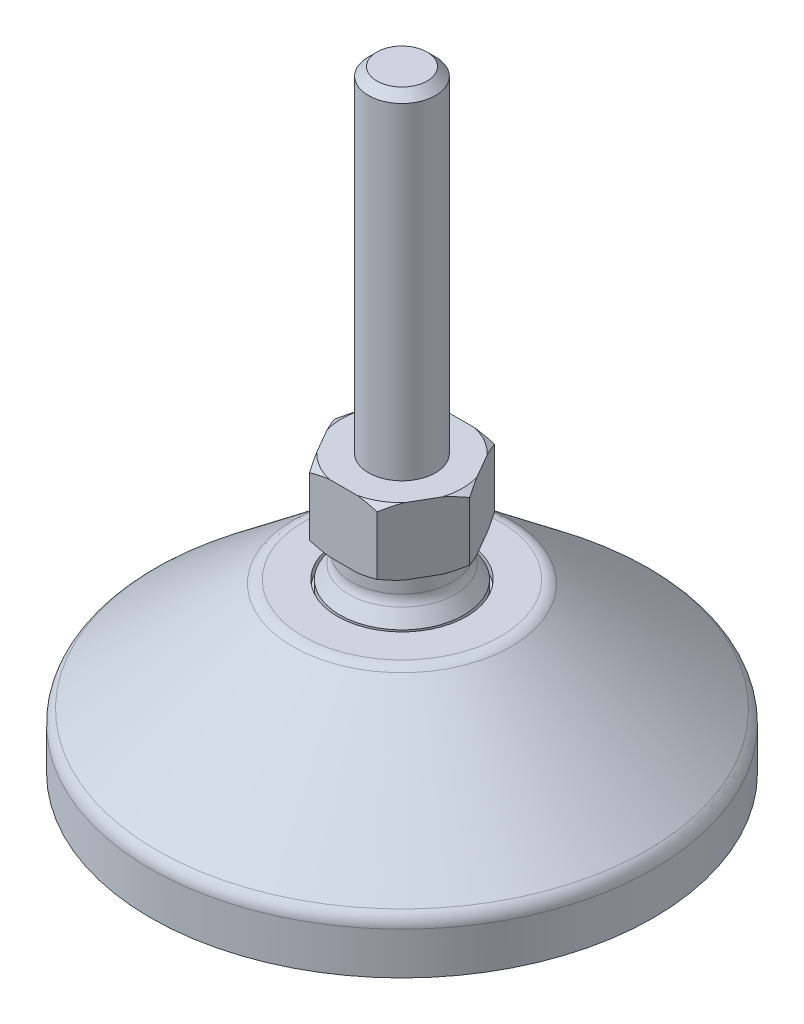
SolidWorks part; units mm, degrees
ref_plane "Front Plane" through (0, 0, 0) normal (0, 0, 1) x (1, 0, 0)
ref_plane "Top Plane" through (0, 0, 0) normal (0, 1, 0) x (1, 0, 0)
ref_plane "Right Plane" through (0, 0, 0) normal (1, 0, 0) x (0, 0, -1)
sketch "Sketch1" plane through (0, 0, 0) normal (0, 1, 0) x (1, 0, 0)
  circle A1 centre (0, 0) radius 25.75
  dimension "D1" = 51.5
extrude "Boss-Extrude1" add sketch "Sketch1" along normal blind 2
sketch "Sketch2" plane through (0, 2, 0) normal (0, 1, 0) x (1, 0, 0)
  circle A0 centre (0, 0) radius 30
  dimension "D1" = 60
extrude "Boss-Extrude2" add sketch "Sketch2" along normal blind 6
ref_plane "Plane1" through (0, 22, 0) normal (0, 1, 0) x (1, 0, 0)
sketch "Sketch3" plane through (0, 22, 0) normal (0, 1, 0) x (1, 0, 0)
  circle A0 centre (0, 0) radius 12.5
  dimension "D1" = 25
loft "Loft1" add profiles "Sketch3"
ref_plane "Plane2" through (0, 24.1, 0) normal (0, 1, 0) x (1, 0, 0)
sketch "Sketch4" plane through (0, 22, 0) normal (0, 1, 0) x (1, 0, 0)
  circle A0 centre (0, 0) radius 7.4
  dimension "D1" = 14.8
sketch "Sketch5" plane through (0, 24.1, 0) normal (0, 1, 0) x (1, 0, 0)
  circle A0 centre (0, 0) radius 6
  dimension "D1" = 12
loft "Loft2" add profiles "Sketch4", "Sketch5"
sketch "Sketch11" plane through (0, 22, 0) normal (0, 1, 0) x (1, 0, 0)
  circle A0 centre (0, 0) radius 7.4 construction
  circle A1 centre (0, 0) radius 7.4
  circle A2 centre (0, 0) radius 7.7
  dimension "D1" = 0.3
extrude "Cut-Extrude1" cut sketch "Sketch11" against normal blind 1
sketch "Sketch6" plane through (0, 24.1, 0) normal (0, 1, 0) x (1, 0, 0)
  circle A1 centre (0, 0) radius 6
  circle A2 centre (0, 0) radius 6
  dimension "D1" = 0
extrude "Boss-Extrude3" add sketch "Sketch6" along normal blind 2.9
sketch "Sketch7" plane through (0, 27, 0) normal (0, 1, 0) x (1, 0, 0)
  circle A0 centre (0, 0) radius 4
  dimension "D1" = 8
extrude "Boss-Extrude4" add sketch "Sketch7" along normal blind 48
sketch "Sketch8" plane through (0, 27, 0) normal (0, 1, 0) x (1, 0, 0)
  line L1 (8.0829, 0) -> (4.0415, 7)
  line L2 (4.0415, 7) -> (-4.0415, 7)
  line L3 (-4.0415, 7) -> (-8.0829, 0)
  line L4 (-8.0829, 0) -> (-4.0415, -7)
  line L5 (-4.0415, -7) -> (4.0415, -7)
  line L6 (4.0415, -7) -> (8.0829, 0)
  circle A0 centre (0, 0) radius 7 construction
  circle A1 centre (0, 0) radius 4 construction
  circle A2 centre (0, 0) radius 4
  dimension "D1" = 14
extrude "Boss-Extrude5" add sketch "Sketch8" along normal blind 8
sketch "Sketch9" plane through (0, 0, 0) normal (0, 0, 1) x (1, 0, 0)
  line L0 (-7.2, 35) -> (-8.0829, 34.5)
  line L1 (-8.0829, 35) -> (-4.0415, 35) construction
  line L2 (-8.0829, 35) -> (-8.0829, 27) construction
  line L3 (-8.0829, 27.5) -> (-7.2, 27)
  line L4 (-8.0829, 27) -> (-4.0415, 27) construction
  line L5 (-7.2, 35) -> (-7.2, 27) construction
  line L6 (0, -33) -> (0, 33) construction
  line L7 (-8.0829, 27.5) -> (-8.0829, 27)
  line L8 (-8.0829, 27) -> (-7.2, 27)
  line L9 (-7.2, 35) -> (-8.0829, 35)
  line L10 (-8.0829, 35) -> (-8.0829, 34.5)
  dimension "D1" = 7.2
  dimension "D2" = 0.5
  dimension "D3" = 0.5
revolve "Cut-Revolve1" cut sketch "Sketch9" angle 360 about axis through (0, 75, 0) along (0, -1, 0)
chamfer "Chamfer1" distance 1 angle 45 1 edges at (0, 75, 4)
sketch "Sketch10" plane through (0, 0, 0) normal (0, -1, 0) x (1, 0, 0)
  line L0 (3, 6) -> (20.6458, 6)
  line L2 (-3, -21.2897) -> (-3, -6)
  line L4 (3, -21.2897) -> (3, -6)
  line L5 (-3, -21.2897) -> (3, 21.2897) construction
  line L6 (-3, 21.2897) -> (3, -21.2897) construction
  line L7 (-20.6458, -6) -> (-3, -6)
  line L9 (-20.6458, 6) -> (-3, 6)
  line L11 (-20.6458, -6) -> (20.6458, 6) construction
  line L12 (-20.6458, 6) -> (20.6458, -6) construction
  line L13 (3, 6) -> (3, 21.2897)
  line L14 (-3, 6) -> (-3, 21.2897)
  line L15 (3, -6) -> (20.6458, -6)
  arc A0 (-20.6458, -6) -> (-3, -21.2897) centre (0, 0) ccw
  arc A1 (20.6458, 6) -> (3, 21.2897) centre (0, 0) ccw
  arc A2 (-3, 21.2897) -> (-20.6458, 6) centre (0, 0) ccw
  arc A3 (3, -21.2897) -> (20.6458, -6) centre (0, 0) ccw
  dimension "D1" = 43
  dimension "D2" = 6
  dimension "D3" = 12
extrude "Boss-Extrude6" add sketch "Sketch10" along normal blind 1
fillet "Fillet1" radius 2 2 edges at (0, 8, 30) (0, 22, 12.5)
fillet "Fillet2" radius 2 1 edges at (0, 24.1, 6)
fillet "Fillet3" radius 1 12 edges at (3, -0.5, -21.2897) (3, -0.5, -6) (20.6458, -0.5, -6) (20.6458, -0.5, 6) (3, -0.5, 21.2897) (3, -0.5, 6) (-3, -0.5, 21.2897) (-3, -0.5, 6) (-20.6458, -0.5, 6) (-20.6458, -0.5, -6) (-3, -0.5, -21.2897) (-3, -0.5, -6)
